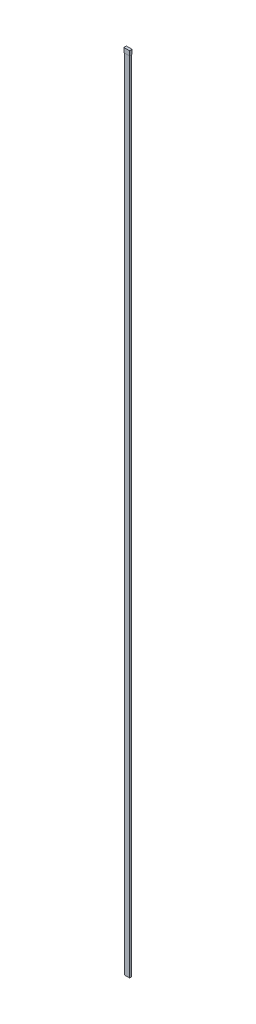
SolidWorks part; units mm, degrees
ref_plane "Front Plane" through (0, 0, 0) normal (0, 0, 1) x (1, 0, 0)
ref_plane "Top Plane" through (0, 0, 0) normal (0, 1, 0) x (1, 0, 0)
ref_plane "Right Plane" through (0, 0, 0) normal (1, 0, 0) x (0, 0, -1)
sketch "Sketch1" plane through (0, 0, 0) normal (0, 0, 1) x (1, 0, 0)
  line L1 (-7.1438, -5.5562) -> (7.1437, -5.5562)
  line L2 (-7.1438, -5.5562) -> (-7.1438, 5.5562)
  line L3 (-7.1438, 5.5562) -> (7.1437, 5.5562)
  line L4 (7.1437, -5.5562) -> (7.1437, 5.5562)
  line L5 (-7.1438, -5.5562) -> (7.1437, 5.5562) construction
  line L6 (-7.1438, 5.5562) -> (7.1437, -5.5562) construction
  point P0 (0, 0)
  point P6 (0, 0)
sketch "Sketch2" plane through (0, 0, 0) normal (0, 0, 1) x (1, 0, 0)
  line L0 (-7.1438, -5.5562) -> (7.1437, -5.5562) construction
  line L1 (-6.35, -1994.4437) -> (6.35, -1994.4437)
  line L2 (-6.35, -1994.4437) -> (-6.35, -5.5562)
  line L3 (-6.35, -5.5562) -> (6.35, -5.5562)
  line L4 (6.35, -1994.4437) -> (6.35, -5.5562)
  line L5 (-6.35, -1994.4437) -> (6.35, -5.5562) construction
  line L6 (-6.35, -5.5562) -> (6.35, -1994.4437) construction
  point P0 (0, -1000)
  point P7 (0, -5.5562)
  point P8 (0, -5.5562)
extrude "Boss-Extrude1" add sketch "Sketch2" along normal mid plane 4.7625
extrude "Boss-Extrude2" add sketch "Sketch1" along normal mid plane 6.35
equation "\"led-strip-cap-width\"= 9 / 16in"
equation "\"led-strip-cap-height\"= 7 / 16in"
equation "\"led-strip-cap-thickness\"= .25in"
equation "\"led-strip-length\"= 2m"
equation "\"led-strip-visible-length\"= \"led-strip-length\" - \"led-strip-cap-height\""
equation "\"led-strip-width\"= .5in"
equation "\"led-strip-thickness\"= 3 / 16in"
equation "\"D1@Sketch1\"=\"led-strip-cap-width\""
equation "\"D2@Sketch1\"=\"led-strip-cap-height\""
equation "\"D1@Sketch2\"=\"led-strip-visible-length\""
equation "\"D2@Sketch2\"=\"led-strip-width\""
equation "\"D1@Boss-Extrude1\"=\"led-strip-thickness\""
equation "\"D1@Boss-Extrude2\"=\"led-strip-cap-thickness\""
